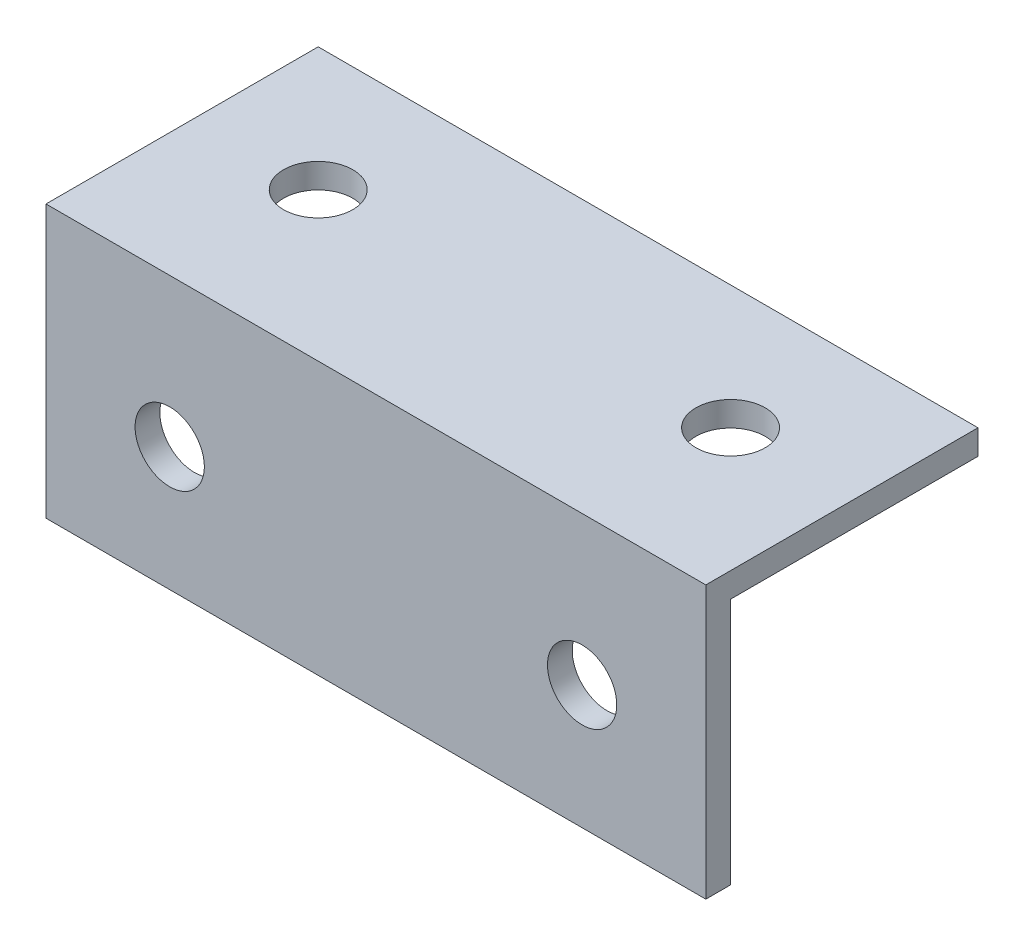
SolidWorks part; units mm, degrees
ref_plane "Front Plane" through (0, 0, 0) normal (1, 0, 0) x (0, 1, 0)
ref_plane "Top Plane" through (0, 0, 0) normal (0, 0, 1) x (0, 1, 0)
ref_plane "Right Plane" through (0, 0, 0) normal (0, 1, 0) x (-1, 0, 0)
sketch "Sketch1" plane through (0, 0, 0) normal (1, 0, 0) x (0, 1, 0)
  line L0 (-19.05, 0) -> (0, 0)
  line L1 (0, 0) -> (0, -19.05)
  line L2 (0, -19.05) -> (1.905, -19.05)
  line L3 (1.905, -19.05) -> (1.905, 1.905)
  line L4 (1.905, 1.905) -> (-19.05, 1.905)
  line L5 (-19.05, 1.905) -> (-19.05, 0)
extrude "Bent_corner_brace" add sketch "Sketch1" along normal blind 50.8
sketch "Sketch2" plane through (0, 0, 0) normal (0, 0, 1) x (0, 1, 0)
  circle A0 centre (-9.525, -9.525) radius 2.667
  circle A1 centre (-9.525, -41.275) radius 2.667
extrude "Top_flange_screw_holes" cut sketch "Sketch2" against normal through all and the other way through all
sketch "Sketch3" plane through (0, 0, 0) normal (0, 1, 0) x (-1, 0, 0)
  circle A0 centre (-9.525, -9.525) radius 2.667
  circle A1 centre (-41.275, -9.525) radius 2.667
extrude "Side_flange_screw_holes" cut sketch "Sketch3" against normal through all and the other way through all
